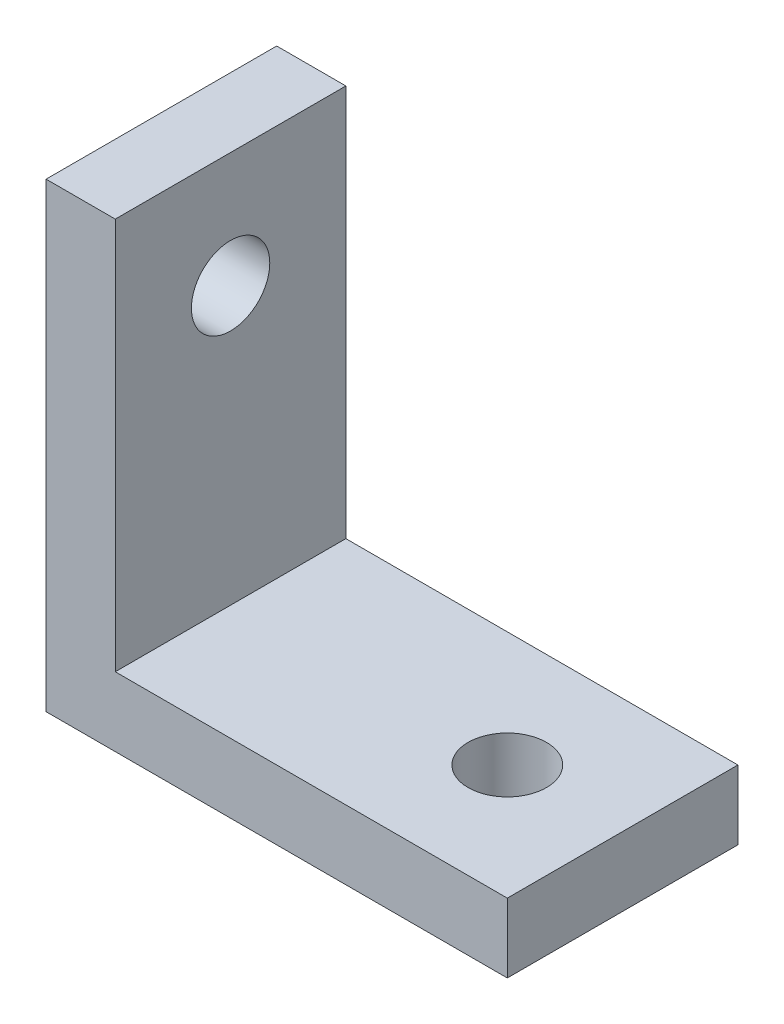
SolidWorks part; units mm, degrees
ref_plane "前视基准面" through (0, 0, 0) normal (0, 0, 1) x (1, 0, 0)
ref_plane "上视基准面" through (0, 0, 0) normal (0, 1, 0) x (1, 0, 0)
ref_plane "右视基准面" through (0, 0, 0) normal (1, 0, 0) x (0, 0, -1)
sketch "草图1" plane through (0, 0, 0) normal (0, 0, 1) x (1, 0, 0)
  line L1 (-10, 10) -> (10, 10)
  line L2 (-10, 10) -> (-10, -10)
  line L3 (-10, -10) -> (10, -10)
  line L4 (10, 10) -> (10, -10)
  line L5 (-10, 10) -> (10, -10) construction
  line L6 (-10, -10) -> (10, 10) construction
  point P0 (0, 0)
  dimension "D1" = 20
  dimension "D2" = 20
extrude "凸台-拉伸1" add sketch "草图1" along normal blind 10
sketch "草图2" plane through (0, 0, 10) normal (0, 0, 1) x (1, 0, 0)
  line L0 (-10, 10) -> (-10, -10) construction
  line L1 (10, 10) -> (-7, 10)
  line L2 (10, 10) -> (10, -7)
  line L3 (10, -7) -> (-7, -7)
  line L4 (-7, 10) -> (-7, -7)
  line L5 (-10, -10) -> (10, -10) construction
  dimension "D1" = 3
  dimension "D2" = 3
extrude "切除-拉伸1" cut sketch "草图2" against normal blind 10
hole_wizard "Ø3.4 (3.4) 直径孔1" positions "草图3" profile "草图4" hole size "Ø3.4" standard "GB"
sketch "草图3" plane through (-7, 0, 0) normal (1, 0, 0) x (0, 0, -1)
  line L0 (0, 10) -> (0, -7) construction
  line L1 (0, 10) -> (-10, 10) construction
  point P0 (-5, 5)
  dimension "D1" = 5
  dimension "D2" = 5
sketch "草图4" plane through (-7, 5, 5) normal (0, 1, 0) x (0, 0, -1)
  line L0 (0, 0) -> (0, 3)
  line L1 (0, 3) -> (1.7, 3)
  line L2 (1.7, 3) -> (1.7, 0)
  line L5 (1.7, 0) -> (0, 0)
  line L11 (0, -6.35) -> (0, 107.95) construction
  dimension "通孔孔直径" = 3.4
  dimension "通孔孔深度" = 3
hole_wizard "Ø3.4 (3.4) 直径孔2" positions "草图5" profile "草图6" hole size "Ø3.4" standard "GB"
sketch "草图5" plane through (0, -7, 0) normal (0, 1, 0) x (1, 0, 0)
  line L0 (10, 0) -> (10, -10) construction
  line L1 (-7, 0) -> (10, 0) construction
  point P0 (5, -5)
  dimension "D1" = 5
  dimension "D2" = 5
sketch "草图6" plane through (5, -7, 5) normal (1, 0, 0) x (0, 0, 1)
  line L0 (0, 0) -> (0, 3)
  line L1 (0, 3) -> (1.7, 3)
  line L2 (1.7, 3) -> (1.7, 0)
  line L5 (1.7, 0) -> (0, 0)
  line L11 (0, -6.35) -> (0, 107.95) construction
  dimension "通孔孔直径" = 3.4
  dimension "通孔孔深度" = 3
